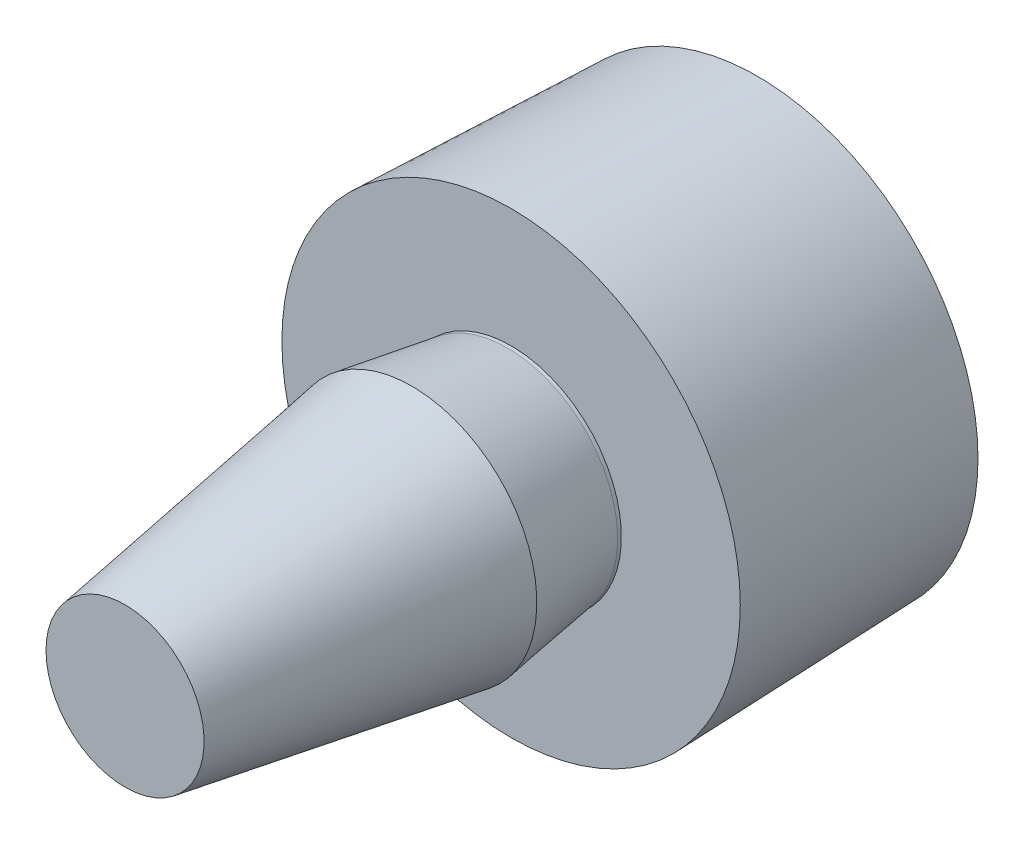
SolidWorks part; units mm, degrees
ref_plane "Plane1" through (0, 0, 0) normal (0, 0, 1) x (1, 0, 0)
ref_plane "Plane2" through (0, 0, 0) normal (0, 1, 0) x (1, 0, 0)
ref_plane "Plane3" through (0, 0, 0) normal (1, 0, 0) x (0, 0, -1)
sketch "Esquisse1" plane through (0, 0, 0) normal (0, 0, 1) x (1, 0, 0)
  circle A0 centre (0, 0) radius 6
  dimension "D1" = 12
extrude "BaseExtrusion" add sketch "Esquisse1" along normal blind 6.7 draft 2
sketch "Esquisse3" plane through (0, 0, 0) normal (1, 0, 0) x (0, 0, -1)
  line L0 (-1.9641, 0) -> (-11.7599, 0) construction
  line L1 (-6.7, 3) -> (-6.8, 3)
  line L2 (-6.7, 6.234) -> (-6.7, -6.234) construction
  line L3 (-6.8, 3) -> (-9.4, 3.4)
  line L4 (-9.4, 3.4) -> (-17.2, 2.15)
  line L5 (-17.2, 2.15) -> (-17.2, 0)
  line L6 (-6.7, 0) -> (-17.2, 0)
  line L7 (-6.7, 3) -> (-6.7, 0)
  dimension "D1" = 3
  dimension "D2" = 3.4
  dimension "D3" = 2.7
  dimension "D4" = 0.1
  dimension "D5" = 2.15
  dimension "D6" = 10.5
revolve "Bossage-Rotation1" add sketch "Esquisse3" angle 360 about L0
